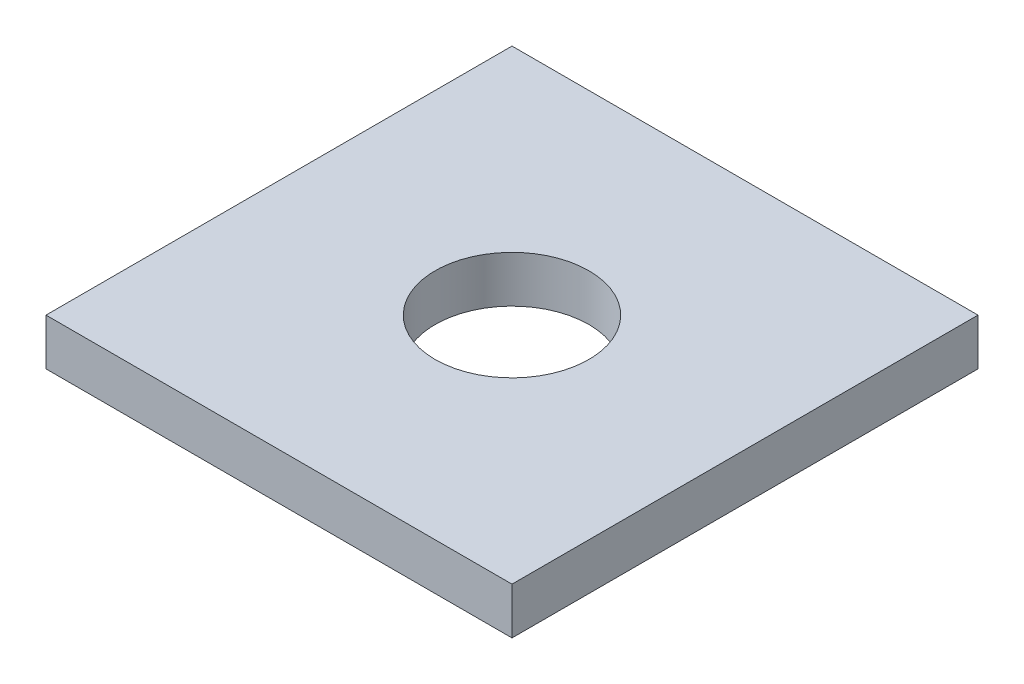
SolidWorks part; units mm, degrees
ref_plane "Front Plane" through (0, 0, 0) normal (0, 0, 1) x (1, 0, 0)
ref_plane "Top Plane" through (0, 0, 0) normal (0, 1, 0) x (1, 0, 0)
ref_plane "Right Plane" through (0, 0, 0) normal (1, 0, 0) x (0, 0, -1)
sketch "Sketch1" plane through (0, 0, 0) normal (0, 1, 0) x (1, 0, 0)
  line L1 (-50, -50) -> (50, -50)
  line L2 (-50, -50) -> (-50, 50)
  line L3 (-50, 50) -> (50, 50)
  line L4 (50, -50) -> (50, 50)
  line L5 (-50, -50) -> (50, 50) construction
  line L6 (-50, 50) -> (50, -50) construction
  circle A0 centre (0, 0) radius 16.5
  point P0 (0, 0)
  dimension "D2" = 33
  dimension "D1" = 100
extrude "Boss-Extrude1" add sketch "Sketch1" along normal blind 10
sketch "Sketch3" plane through (0, 0, 0) normal (0, -1, 0) x (1, 0, 0)
  line L0 (-36, 36) -> (36, 36)
  line L1 (-40, -40) -> (40, -40)
  line L2 (-40, -40) -> (-40, 40)
  line L3 (-40, 40) -> (40, 40)
  line L4 (40, -40) -> (40, 40)
  line L5 (-40, -40) -> (40, 40) construction
  line L6 (-40, 40) -> (40, -40) construction
  line L7 (36, -36) -> (36, 36)
  line L8 (-36, -36) -> (36, -36)
  line L9 (-36, -36) -> (-36, 36)
  point P0 (0, 0)
  dimension "D1" = 80
  dimension "D2" = 4
extrude "Boss-Extrude2" add sketch "Sketch3" along normal blind 10
